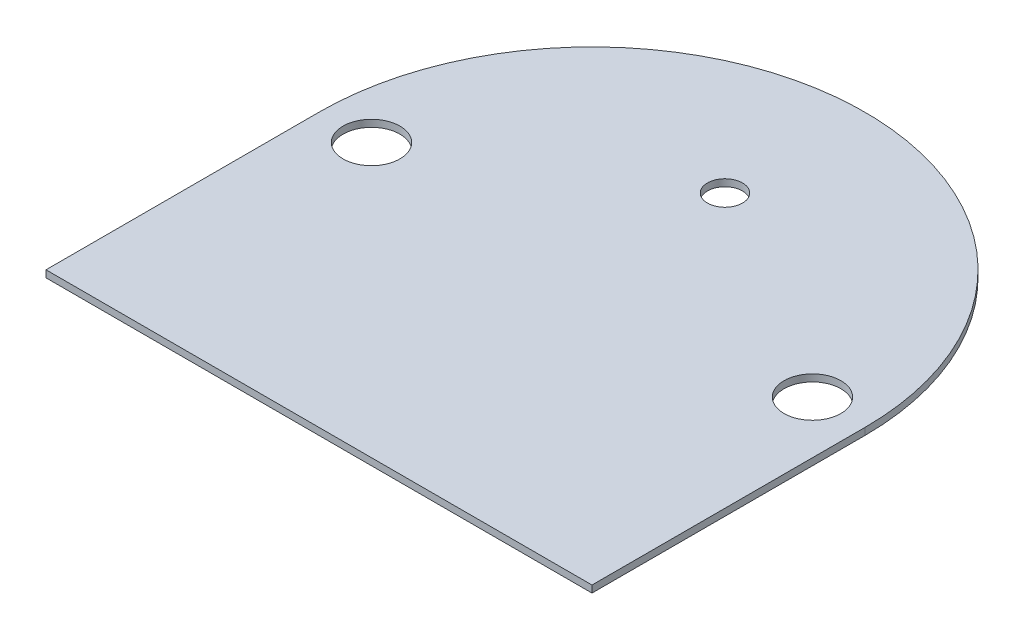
SolidWorks part; units mm, degrees
ref_plane "Front Plane" through (0, 0, 0) normal (0, 0, 1) x (1, 0, 0)
ref_plane "Top Plane" through (0, 0, 0) normal (0, 1, 0) x (1, 0, 0)
ref_plane "Right Plane" through (0, 0, 0) normal (1, 0, 0) x (0, 0, -1)
sketch "Sketch1" plane through (0, 0, 0) normal (0, 1, 0) x (1, 0, 0)
  line L1 (-99.06, 0) -> (99.06, 0)
  line L2 (-99.06, 0) -> (-99.06, -99.06)
  line L3 (-99.06, -99.06) -> (99.06, -99.06)
  line L4 (99.06, 0) -> (99.06, -99.06)
  circle A0 centre (0, 0) radius 99.06
  dimension "D1" = 198.12
extrude "Boss-Extrude1" add sketch "Sketch1" along normal blind 2.54 contours L1 A0 | A0 L1 | A0 L2 L3 | A0 L3 L4
sketch "Sketch2" plane through (0, 2.54, 0) normal (0, 1, 0) x (1, 0, 0)
  line L0 (0, 0) -> (-80.01, 0) construction
  line L1 (0, 0) -> (80.01, 0) construction
  line L2 (-99.06, 0) -> (-99.06, -99.06) construction
  line L3 (0, 0) -> (0, 99.06) construction
  circle A0 centre (-80.01, 0) radius 10.3187
  arc A1 (99.06, 0) -> (-99.06, 0) centre (0, 0) ccw construction
  circle A2 centre (80.01, 0) radius 10.3187
  circle A3 centre (0, 48.26) radius 6.35
  dimension "D2" = 20.6375
  dimension "D4" = 12.7
  dimension "D1" = 19.05
  dimension "D3" = 50.8
extrude "Cut-Extrude1" cut sketch "Sketch2" against normal through all
